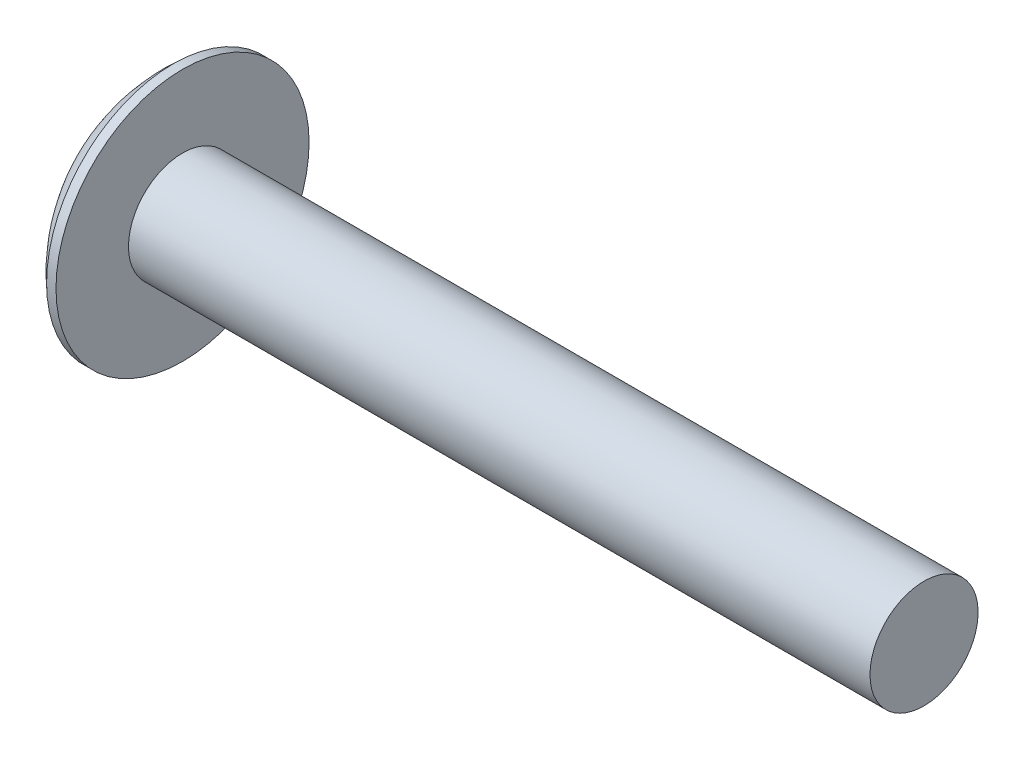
SolidWorks part; units mm, degrees
ref_plane "Plane1" through (0, 0, 0) normal (0, 0, 1) x (1, 0, 0)
ref_plane "Plane2" through (0, 0, 0) normal (0, 1, 0) x (1, 0, 0)
ref_plane "Plane3" through (0, 0, 0) normal (1, 0, 0) x (0, 0, -1)
sketch "BodySke" plane through (0, 0, 0) normal (0, 0, 1) x (1, 0, 0)
  line L0 (2.5908, 2.0828) -> (2.5908, 4.8768)
  line L1 (31.1658, 0) -> (0, 0)
  line L2 (-25.4, 0) -> (127, 0) construction
  line L3 (2.2279, -4.8768) -> (2.5908, -4.8768) construction
  line L4 (2.5908, 2.0828) -> (31.1658, 2.0828)
  line L5 (31.1658, 2.0828) -> (31.1658, 0)
  line L6 (2.2279, 4.8768) -> (2.5908, 4.8768)
  line L7 (2.5908, -2.0828) -> (31.1658, -2.0828) construction
  line L8 (3.3833, 3.6703) -> (3.3833, -5.8547) construction
  line L9 (2.5908, 6.35) -> (2.5908, -3.175) construction
  arc A0 (2.2279, 4.8768) -> (0, 0) centre (6.4516, 0) ccw
  dimension "Head_rad" = 6.4516
  dimension "Head_ht" = 2.5908
  dimension "Diameter" = 4.1656
  dimension "Length" = 28.575
  dimension "Head_dia" = 9.7536
  dimension "Advance" = 0.7925
  dimension "Thread_nom" = 28.575
revolve "Base-Revolve" add sketch "BodySke" angle 360 about L2
sketch "Sketch2" plane through (0, 0, 0) normal (1, 0, 0) x (0, 0, -1)
  line L0 (4.8768, -0.6858) -> (-4.8768, -0.6858)
  line L1 (4.8768, -0.6858) -> (4.8768, 0.6858)
  line L2 (-4.8768, 0.6858) -> (4.8768, 0.6858)
  line L3 (-4.8768, 0.6858) -> (-4.8768, -0.6858)
  dimension "D1" = 9.7536
  dimension "D2" = 4.8768
  dimension "Slot_width" = 1.3716
  dimension "D3" = 0.6858
extrude "Slot" [suppressed] cut sketch "Sketch2" along normal blind 1.4732
sketch "Sketch3" plane through (0, 0, 0) normal (1, 0, 0) x (0, 0, -1)
  line L0 (0.5207, -2.7305) -> (-0.5207, -2.7305)
  line L1 (0.5207, -2.7305) -> (0.5207, 2.7305)
  line L2 (-0.5207, 2.7305) -> (0.5207, 2.7305)
  line L3 (-0.5207, 2.7305) -> (-0.5207, -2.7305)
  dimension "D1" = 0.5207
  dimension "Cross_width" = 1.0414
  dimension "Cross_dia" = 5.461
  dimension "D2" = 2.7305
ref_plane "Plane4" through (3.0734, 0, 0) normal (1, 0, 0) x (0, 0, -1)
sketch "Sketch4" plane through (3.0734, 0, 0) normal (1, 0, 0) x (0, 0, -1)
  line L0 (0.2604, -0.2604) -> (-0.2603, -0.2604)
  line L1 (0.2604, -0.2604) -> (0.2604, 0.2604)
  line L2 (-0.2603, 0.2604) -> (0.2604, 0.2604)
  line L3 (-0.2603, 0.2604) -> (-0.2603, -0.2604)
  dimension "D1" = 0.5207
  dimension "D2" = 0.2604
  dimension "D3" = 0.5207
  dimension "D4" = 0.2604
loft "Cross" cut profiles "Sketch3", "Sketch4"
pattern_circular "CirPattern1" count 2 every 90 about axis through (0, 0, 0) along (1, 0, 0) of "Cross"
sketch "ThdSchSke" plane through (0, 0, 0) normal (0, 0, 1) x (1, 0, 0)
  line L0 (3.3833, -1.6104) -> (3.0525, -2.0828)
  line L1 (3.3833, -1.6104) -> (3.7141, -2.0828)
  line L2 (3.7141, -2.0828) -> (3.7141, -2.6035)
  line L3 (-3.175, 0) -> (5.1513, 0) construction
  line L5 (3.7141, -2.6035) -> (3.0525, -2.6035)
  line L6 (3.0525, -2.6035) -> (3.0525, -2.0828)
  dimension "Thread_minor" = 3.2207
  dimension "Diameter" = 4.1656
  dimension "Start" = 3.3833
  dimension "SideAngle" = 55
  dimension "VeeAngle" = 70
  dimension "Overcut" = 5.207
revolve "ThreadSchematic" [suppressed] cut sketch "ThdSchSke" angle 360 about L3
pattern_linear "ThdSchPat" [suppressed]
equation "\"D1@Sketch2\" = \"Head_dia@BodySke\""
equation "\"D2@Sketch2\" = \"D1@Sketch2\" / 2"
equation "\"D3@Sketch2\" = \"Slot_width@Sketch2\" / 2"
equation "\"D1@Sketch3\" = \"Cross_width@Sketch3\" / 2"
equation "\"D2@Sketch3\" = \"Cross_dia@Sketch3\" / 2"
equation "\"D1@Sketch4\" = \"Cross_width@Sketch3\" *.5"
equation "\"D2@Sketch4\" = \"D1@Sketch4\" / 2"
equation "\"D3@Sketch4\" = \"D1@Sketch4\""
equation "\"D4@Sketch4\" = \"D3@Sketch4\" / 2"
equation "\"Thread_length@ThreadCosmetic\" = ((sgn( (\"Length@BodySke\" - \"Advance@BodySke\" ) - \"Thread_nom@BodySke\" )-1)*( (\"Length@BodySke\" - \"Advance@BodySke\" ) - \"Thread_nom@BodySke\" ))/-2+ \"Thread_nom@BodySke\""
equation "\"Thread_minor@ThdSchSke\" = \"Thread_minor@ThreadCosmetic\""
equation "\"Diameter@ThdSchSke\" = \"Diameter@BodySke\""
equation "\"Overcut@ThdSchSke\" = \"Diameter@BodySke\" * 1.25"
equation "\"Start@ThdSchSke\" = \"Head_ht@BodySke\" + \"Length@BodySke\" - \"Thread_length@ThreadCosmetic\"  '---Non-countersunk---"
equation "\"Num_threads@ThdSchPat\" = int( \"Thread_length@ThreadCosmetic\" / \"Advance@BodySke\" + 0.999 )  + 1"
equation "\"Advance@ThdSchPat\" = \"Thread_length@ThreadCosmetic\" /  (\"Num_threads@ThdSchPat\" - 1) 'relax it"
